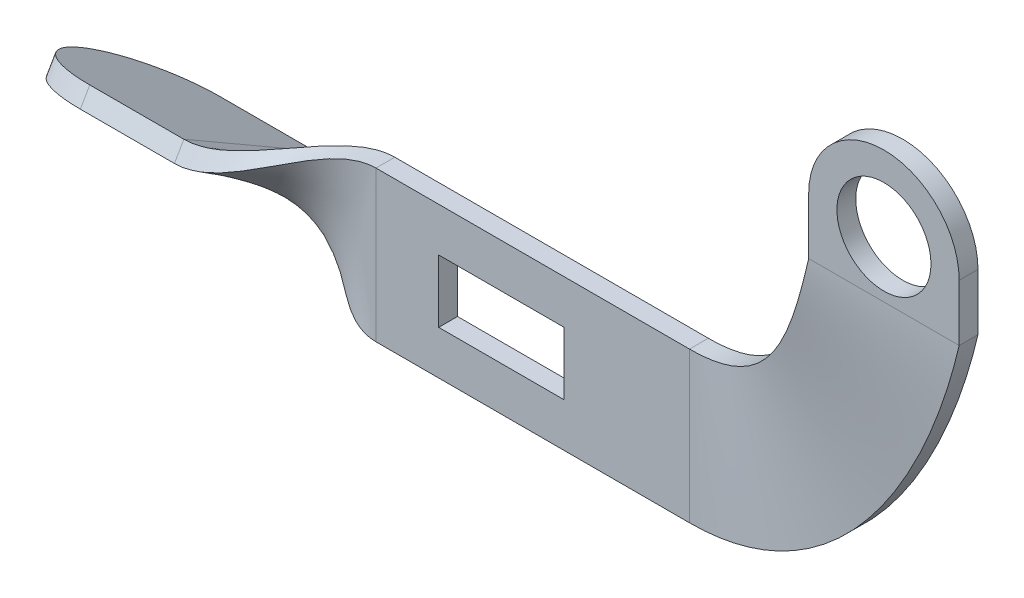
SolidWorks part; units mm, degrees
ref_plane "Front Plane" through (0, 0, 0) normal (0, 0, 1) x (1, 0, 0)
ref_plane "Top Plane" through (0, 0, 0) normal (0, 1, 0) x (1, 0, 0)
ref_plane "Right Plane" through (0, 0, 0) normal (1, 0, 0) x (0, 0, -1)
mirrored part "Продольная полоса_Зеркально отражен"
other "<Продольная полоса>-<Граница2>"
